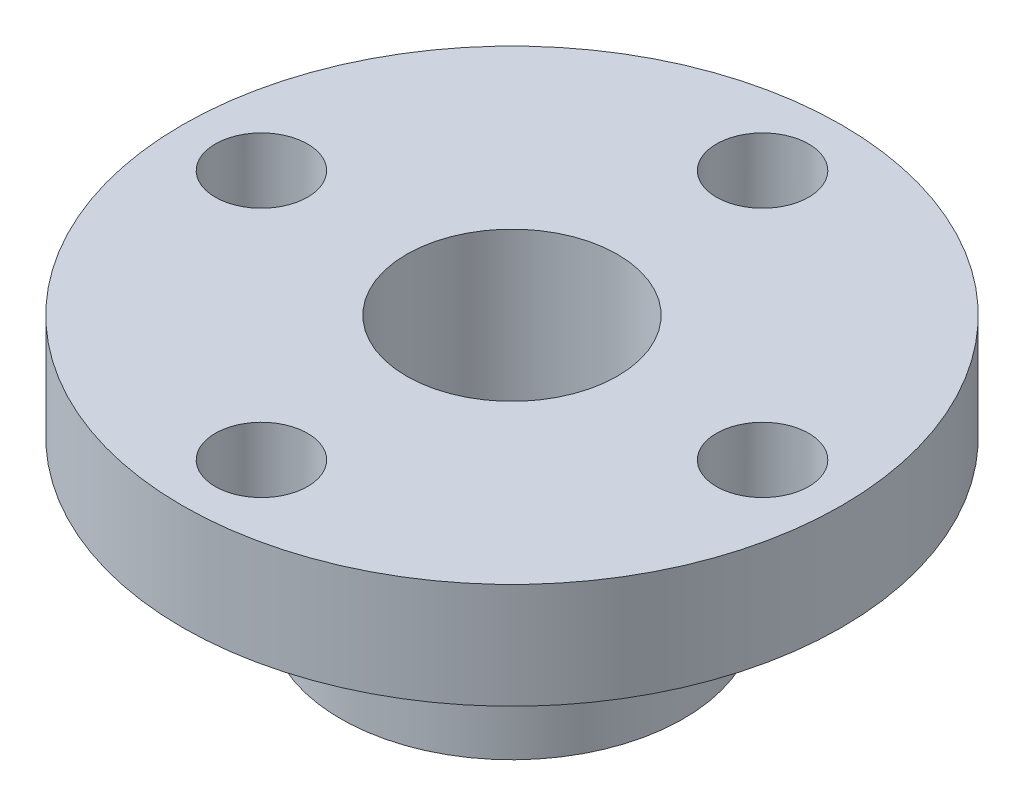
SolidWorks part; units mm, degrees
ref_plane "Front Plane" through (0, 0, 0) normal (0, 0, 1) x (1, 0, 0)
ref_plane "Top Plane" through (0, 0, 0) normal (0, 1, 0) x (1, 0, 0)
ref_plane "Right Plane" through (0, 0, 0) normal (1, 0, 0) x (0, 0, -1)
sketch "Sketch1" plane through (0, 0, 0) normal (0, 0, 1) x (1, 0, 0)
  line L0 (0, 0) -> (12.5, 0)
  line L1 (12.5, 0) -> (12.5, -4)
  line L2 (12.5, -4) -> (6.5, -4)
  line L3 (6.5, -4) -> (6.5, -10)
  line L4 (6.5, -10) -> (0, -10)
  line L5 (0, -10) -> (0, 0)
  dimension "D1" = 12.5
  dimension "D2" = 4
  dimension "D3" = 10
  dimension "D4" = 6.5
revolve "Revolve1" add sketch "Sketch1" angle 360 about L5
sketch "Sketch2" plane through (0, 0, 0) normal (0, 1, 0) x (1, 0, 0)
  line L0 (0, 0) -> (0, 12.5) construction
  circle A0 centre (0, 0) radius 4
  circle A1 centre (0, 0) radius 12.5 construction
  circle A2 centre (0, 9.5) radius 1.75
  circle A3 centre (9.5, 0) radius 1.75
  circle A4 centre (0, -9.5) radius 1.75
  circle A5 centre (-9.5, 0) radius 1.75
  point P9 (-19.4456, -1.8037)
  point P10 (0, 0)
  point P18 (0, 0)
  dimension "D1" = 3.5
  dimension "D2" = 8
  dimension "D3" = 9.5
  dimension "D4" = 4
extrude "Cut-Extrude1" cut sketch "Sketch2" against normal through all
